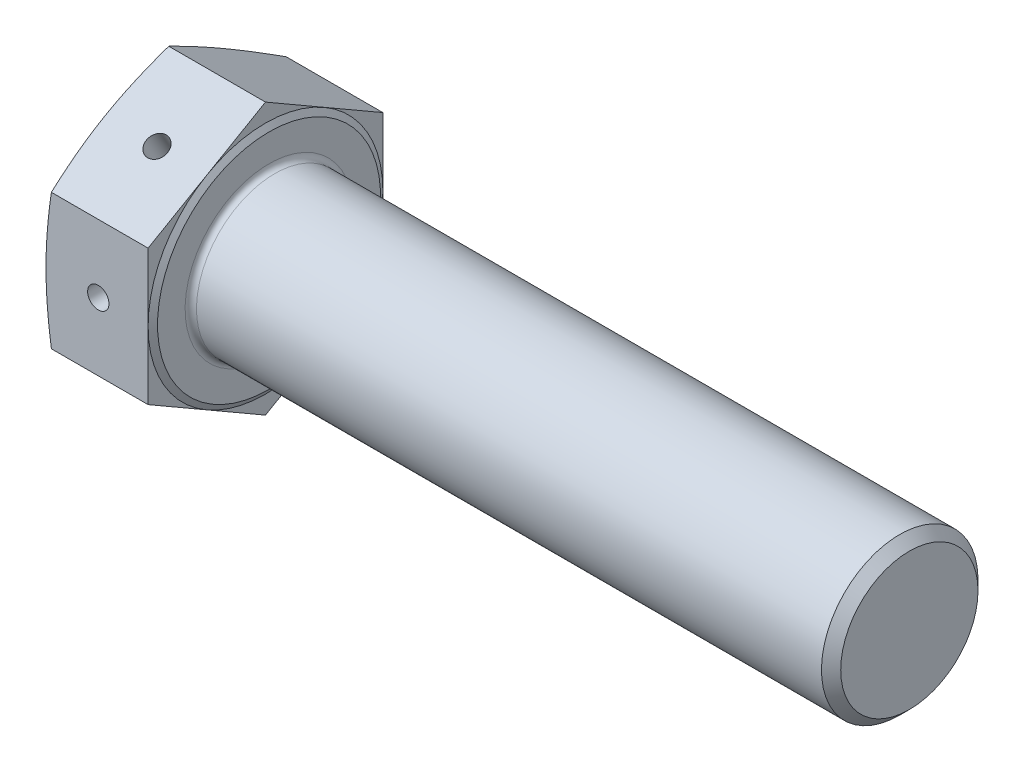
SolidWorks part; units mm, degrees
ref_plane "Front" through (0, 0, 0) normal (0, 0, 1) x (1, 0, 0)
ref_plane "Top" through (0, 0, 0) normal (0, 1, 0) x (1, 0, 0)
ref_plane "Right" through (0, 0, 0) normal (1, 0, 0) x (0, 0, -1)
sketch "Sketch-BaseHead" plane through (0, 0, 0) normal (1, 0, 0) x (0, 0, -1)
  line L1 (0, -19.0526) -> (16.5, -9.5263)
  line L2 (16.5, -9.5263) -> (16.5, 9.5263)
  line L3 (16.5, 9.5263) -> (0, 19.0526)
  line L4 (0, 19.0526) -> (-16.5, 9.5263)
  line L5 (-16.5, 9.5263) -> (-16.5, -9.5263)
  line L6 (-16.5, -9.5263) -> (0, -19.0526)
  circle A0 centre (0, 0) radius 16.5 construction
  dimension "s" = 33
extrude "BaseHead" add sketch "Sketch-BaseHead" along normal blind 14.35
sketch "Sketch4" plane through (-0.2646, -5.9169, 0) normal (0, 0, 1) x (0, 1, 0)
  line L0 (5.9169, 3.7369) -> (5.9169, -10.4477) construction
  line L2 (24.9695, -0.2646) -> (22.4169, -0.2646)
  line L4 (22.4169, -0.2646) -> (24.9695, -1.0207)
  line L6 (24.9695, -1.0207) -> (24.9695, -0.2646)
  dimension "D1" = 16.5
  dimension "D2" = 33
revolve "HeadChamfer" cut sketch "Sketch4" angle 360 about L0
sketch "Sketch2" plane through (0, 0, 0) normal (0, 1, 0) x (1, 0, 0)
  line L0 (14.35, 0) -> (14.85, 0)
  line L1 (14.85, 0) -> (14.85, 15.675)
  line L2 (14.85, 15.675) -> (14.35, 16.5)
  line L3 (14.35, 16.5) -> (14.35, 0)
  line L4 (14.35, 16.5) -> (14.35, 0) construction
  dimension "D1" = 16.5
  dimension "D2" = 15.675
  dimension "c" = 0.5
revolve "Revolve1" add sketch "Sketch2" angle 360 about axis through (-4.0016, 0, 0) along (1, 0, 0)
ref_plane "Plane2" through (54.85, 0, 0) normal (1, 0, 0) x (0, 0, -1)
sketch "Sketch3" plane through (14.85, 0, 0) normal (1, 0, 0) x (0, 0, -1)
  circle A0 centre (0, 0) radius 11
  dimension "d" = 22
extrude "BaseBody" add sketch "Sketch3" along normal blind 90
chamfer "Chamfer1" distance 1.353 angle 45 1 edges at (104.85, 11, 0)
fillet "HeadFillet" radius 0.8 1 edges at (14.85, -11, 0)
sketch "Sketch5" plane through (0, 0, 0) normal (0, 0, 1) x (1, 0, 0)
  line L1 (14.35, -14.2894) -> (14.35, -19.0526) construction
  line L2 (-4.0016, 0) -> (10.1831, 0) construction
  circle A0 centre (7.35, 0) radius 1.5
  dimension "d1" = 3
  dimension "h" = 7
extrude "Hole" cut sketch "Sketch5" against normal through all and the other way through all
pattern_circular "CirPattern1" count 2 over 60 about axis through (104.85, 0, 0) along (-1, 0, 0) of "Hole"
equation "\"D1@Sketch4\" = \"s@Sketch-BaseHead\"/ 2 "
equation "\"D2@Sketch4\" = \"s@Sketch-BaseHead\""
equation "\"D1@Chamfer1\" =  ( \"d@Sketch3\" - \"D2@ThreadCosmetic1\" ) / 2 "
equation "\"b@ThreadCosmetic1\" = \"l@BaseBody\" - \"lg@Plane2\""
equation "\"D1@Sketch2\"=\"s@Sketch-BaseHead\"/2"
